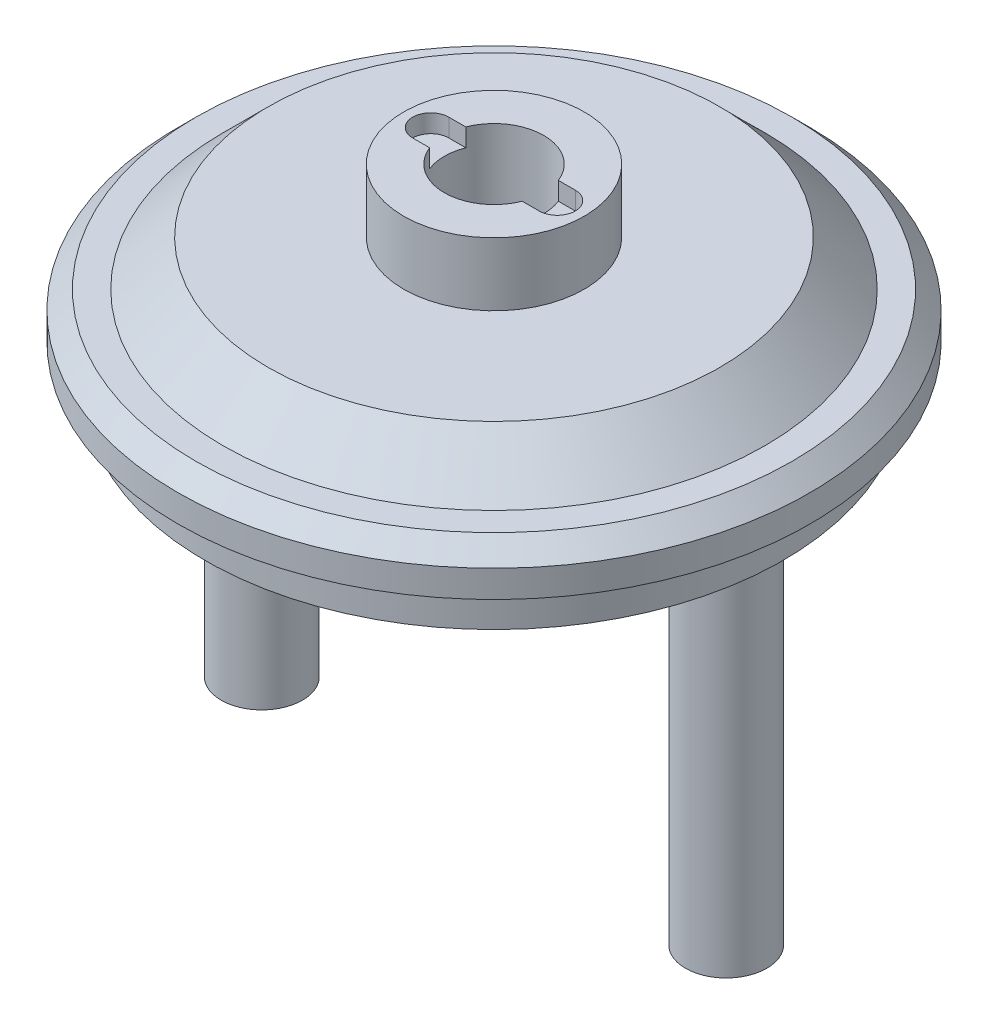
SolidWorks part; units mm, degrees
ref_plane "Plan de face" through (0, 0, 0) normal (0, 0, 1) x (1, 0, 0)
ref_plane "Plan de dessus" through (0, 0, 0) normal (0, 1, 0) x (1, 0, 0)
ref_plane "Plan de droite" through (0, 0, 0) normal (1, 0, 0) x (0, 0, -1)
sketch "Esquisse1" plane through (0, 0, 0) normal (0, 1, 0) x (1, 0, 0)
  circle A0 centre (0, 0) radius 35
  dimension "D1" = 70
extrude "Boss.-Extru.1" add sketch "Esquisse1" along normal blind 15
sketch "Esquisse2" plane through (0, 0, 0) normal (0, -1, 0) x (1, 0, 0)
  circle A0 centre (0, 0) radius 32
  circle A1 centre (0, 0) radius 35
  circle A2 centre (0, 0) radius 35 construction
  dimension "D1" = 3
  dimension "D2" = 0
extrude "Enlèv. mat.-Extru.1" cut sketch "Esquisse2" against normal blind 5
sketch "Esquisse3" plane through (0, 0, 0) normal (0, -1, 0) x (1, 0, 0)
  circle A0 centre (-25.7, 0) radius 4.5
  circle A1 centre (25.7, 0) radius 4.5
  dimension "D3" = 9
  dimension "D4" = 9
  dimension "D1" = 25.7
  dimension "D2" = 25.7
extrude "Boss.-Extru.2" add sketch "Esquisse3" along normal blind 40
sketch "Esquisse4" plane through (0, 15, 0) normal (0, 1, 0) x (1, 0, 0)
  circle A0 centre (0, 0) radius 30
  circle A1 centre (0, 0) radius 35 construction
  circle A2 centre (0, 0) radius 35
  dimension "D1" = 5
extrude "Enlèv. mat.-Extru.2" cut sketch "Esquisse4" against normal blind 5
sketch "Esquisse5" plane through (0, 15, 0) normal (0, 1, 0) x (1, 0, 0)
  circle A0 centre (0, 0) radius 10
  dimension "D1" = 20
extrude "Boss.-Extru.3" add sketch "Esquisse5" along normal blind 7
sketch "Esquisse6" plane through (0, 22, 0) normal (0, 1, 0) x (1, 0, 0)
  circle A0 centre (0, 0) radius 5.5
  dimension "D1" = 11
extrude "Enlèv. mat.-Extru.3" cut sketch "Esquisse6" against normal blind 30
sketch "Esquisse7" plane through (0, 22, 0) normal (0, 1, 0) x (1, 0, 0)
  line L0 (-7, 0) -> (7, 0) construction
  line L1 (-7, 2) -> (7, 2)
  line L2 (-7, -2) -> (7, -2)
  arc A0 (-7, 2) -> (-7, -2) centre (-7, 0) ccw
  arc A1 (7, -2) -> (7, 2) centre (7, 0) ccw
  point P3 (0, 0)
  dimension "D1" = 7
  dimension "D2" = 7
  dimension "D3" = 2
extrude "Enlèv. mat.-Extru.4" cut sketch "Esquisse7" against normal blind 2
chamfer "Chanfrein1" distance 5 angle 45 1 edges at (0, 15, 30)
chamfer "Chanfrein2" distance 2 angle 45 1 edges at (0, 10, 35)
